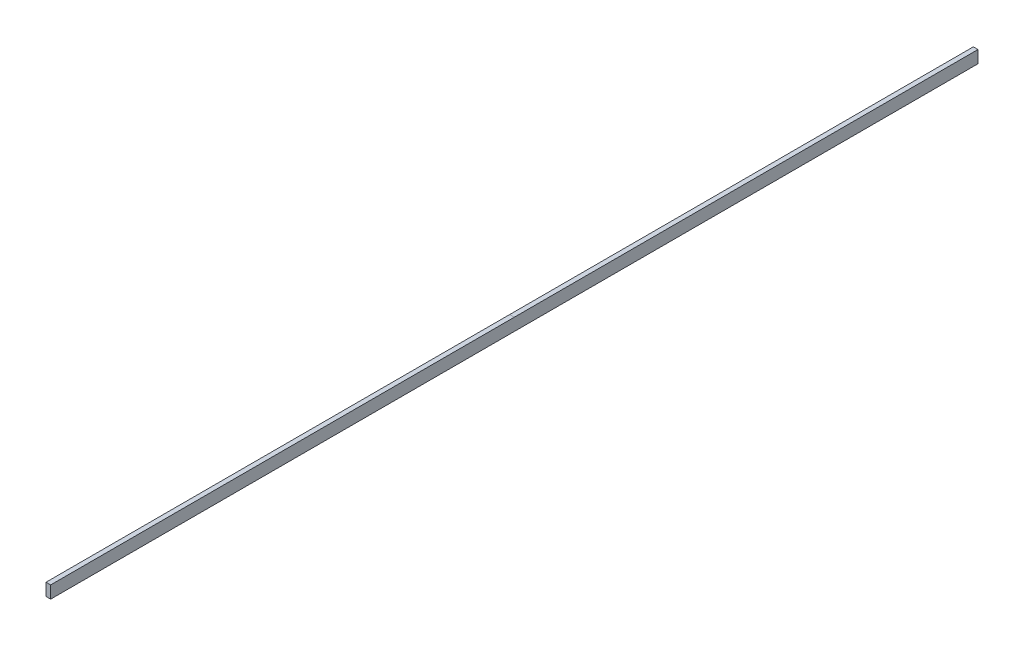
SolidWorks part; units mm, degrees
ref_plane "Alzado" through (0, 0, 0) normal (0, 0, 1) x (1, 0, 0)
ref_plane "Planta" through (0, 0, 0) normal (0, 1, 0) x (1, 0, 0)
ref_plane "Vista lateral" through (0, 0, 0) normal (1, 0, 0) x (0, 0, -1)
sketch "Croquis1" plane through (0, 0, 0) normal (0, 0, 1) x (1, 0, 0)
  line L0 (-15, 40) -> (15, -40) construction
  line L1 (-15, 40) -> (15, 40)
  line L2 (-15, 40) -> (-15, -40)
  line L3 (-15, -40) -> (15, -40)
  line L4 (15, 40) -> (15, -40)
  dimension "D1" = 30
  dimension "D2" = 80
extrude "Extruir1" add sketch "Croquis1" along normal blind 3000
sketch "Croquis2" plane through (0, 0, 3000) normal (0, 0, 1) x (1, 0, 0)
  line L1 (-15, 40) -> (15, 40)
  line L2 (-15, 40) -> (-15, -40)
  line L3 (-15, -40) -> (15, -40)
  line L4 (15, 40) -> (15, -40)
extrude "Extruir2" add sketch "Croquis2" along normal blind 3000
sketch "Croquis3" plane through (0, 40, 0) normal (0, 1, 0) x (1, 0, 0)
  line L0 (-758.9246, -3000) -> (767.4042, -3000)
  dimension "D1" = 3000
sketch "Croquis4" plane through (0, 40, 0) normal (0, 1, 0) x (1, 0, 0)
  line L0 (-15, -6000) -> (-15, -3000) construction
  line L1 (15, -6000) -> (-15, -6000) construction
  point P0 (0, -4000)
  dimension "D1" = 15
  dimension "D2" = 2000
ref_point "Punto1"
sketch "Croquis5" plane through (0, 40, 0) normal (0, 1, 0) x (1, 0, 0)
  line L0 (-15, -3000) -> (-15, 0) construction
  line L1 (15, 0) -> (-15, 0) construction
  point P0 (0, -1500)
  dimension "D1" = 15
  dimension "D2" = 1500
